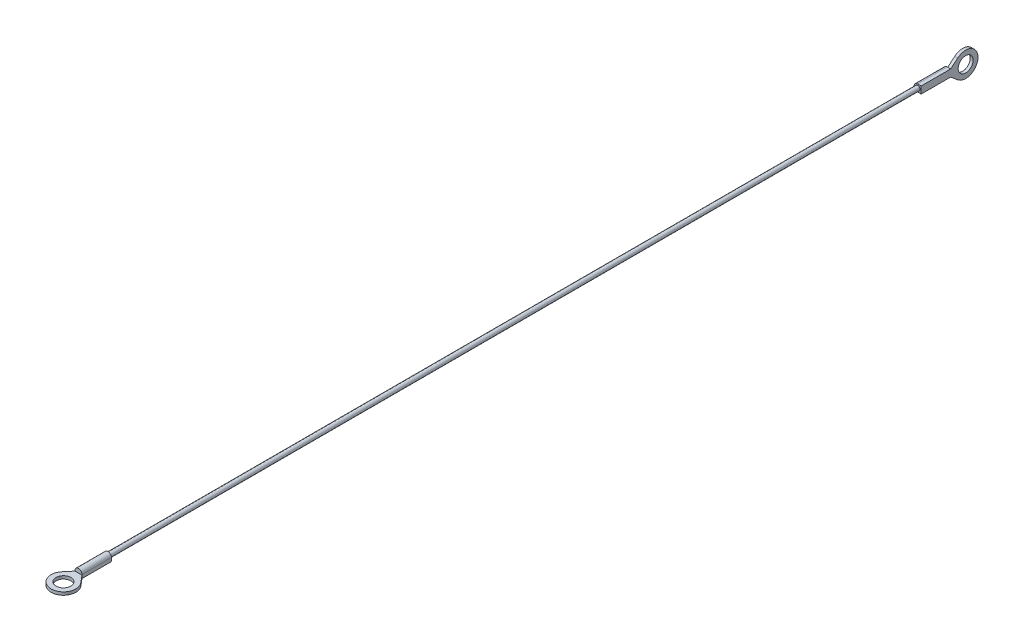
SolidWorks part; units mm, degrees
ref_plane "Front Plane" through (0, 0, 0) normal (0, 0, 1) x (1, 0, 0)
ref_plane "Top Plane" through (0, 0, 0) normal (0, 1, 0) x (1, 0, 0)
ref_plane "Right Plane" through (0, 0, 0) normal (1, 0, 0) x (0, 0, -1)
sketch "Sketch1" plane through (0, 0, 0) normal (0, 0, 1) x (1, 0, 0)
  circle A0 centre (0, 0) radius 0.795
extrude "Boss-Extrude1" add sketch "Sketch1" along normal mid plane 274.64
sketch "Sketch2" plane through (0, 0, 137.32) normal (0, 0, 1) x (1, 0, 0)
  line L0 (-1.195, 0) -> (-1.195, -1.195)
  line L1 (-1.195, -1.195) -> (0, -1.195)
  line L2 (0, -1.195) -> (1.195, -1.195)
  line L3 (1.195, -1.195) -> (1.195, 0)
  arc A0 (1.195, 0) -> (-1.195, 0) centre (0, 0) ccw
  dimension "D1" = 2.39
extrude "Boss-Extrude2" add sketch "Sketch2" along normal blind 10
sketch "Sketch3" plane through (0, -1.195, 0) normal (0, -1, 0) x (1, 0, 0)
  line L0 (1.195, 147.32) -> (3.2017, 149.6972)
  line L1 (-3.2017, 149.6972) -> (-1.195, 147.32)
  line L2 (-1.195, 147.32) -> (1.195, 147.32)
  arc A0 (3.2017, 149.6972) -> (-3.2017, 149.6972) centre (0, 152.4) ccw
  circle A1 centre (0, 152.4) radius 2.54
  point P8 (4.19, 152.4)
  point P9 (-4.19, 152.4)
  dimension "D1" = 5.08
  dimension "D2" = 8.38
  dimension "D3" = 152.4
extrude "Boss-Extrude3" add sketch "Sketch3" against normal blind 1.01
sketch "Sketch4" plane through (0, 0, -137.32) normal (0, 0, -1) x (-1, 0, 0)
  line L0 (0, 1.195) -> (-1.195, 1.195)
  line L1 (-1.195, 1.195) -> (-1.195, 0)
  line L2 (-1.195, 0) -> (-1.195, -1.195)
  line L3 (-1.195, -1.195) -> (0, -1.195)
  arc A0 (0, -1.195) -> (0, 1.195) centre (0, 0) ccw
  dimension "D1" = 2.39
extrude "Boss-Extrude4" add sketch "Sketch4" along normal blind 10
sketch "Sketch5" plane through (1.195, 0, 0) normal (1, 0, 0) x (0, 0, -1)
  line L0 (147.32, -1.195) -> (147.32, 1.195)
  line L1 (147.32, 1.195) -> (149.6972, 3.2017)
  line L2 (149.6972, -3.2017) -> (147.32, -1.195)
  arc A0 (149.6972, 3.2017) -> (149.6972, -3.2017) centre (152.4, 0) cw
  circle A1 centre (152.4, 0) radius 2.54
  point P8 (152.4, 4.19)
  point P9 (152.4, -4.19)
  dimension "D1" = 5.08
  dimension "D2" = 8.38
  dimension "D3" = 152.4
extrude "Boss-Extrude5" add sketch "Sketch5" against normal blind 1.01
